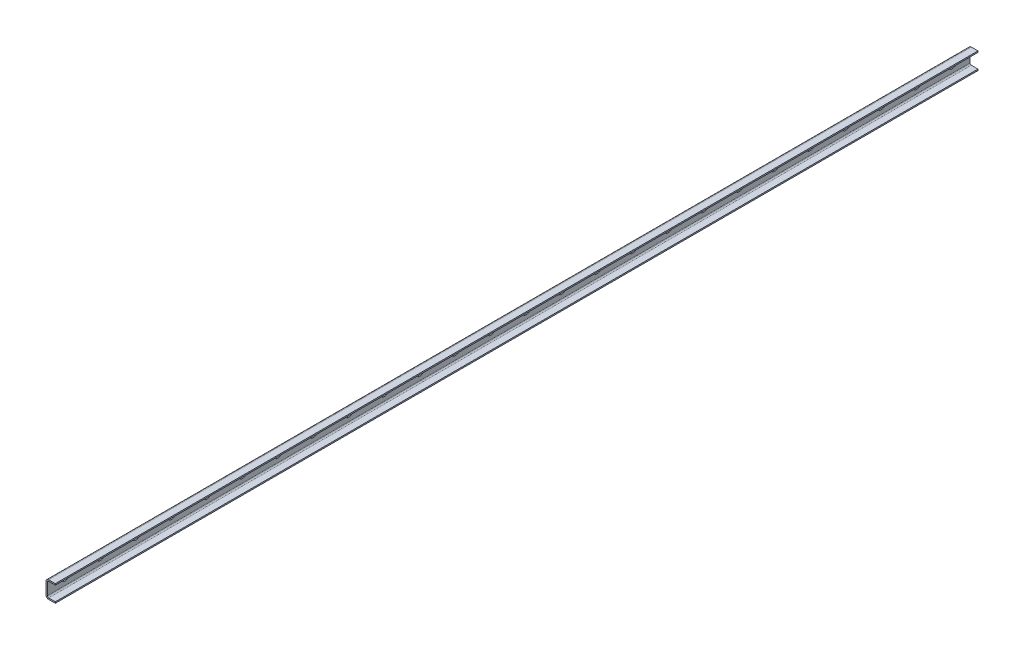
SolidWorks part; units mm, degrees
ref_plane "Front Plane" through (0, 0, 0) normal (0, 0, 1) x (1, 0, 0)
ref_plane "Top Plane" through (0, 0, 0) normal (0, 1, 0) x (1, 0, 0)
ref_plane "Right Plane" through (0, 0, 0) normal (1, 0, 0) x (0, 0, -1)
sketch "Sketch1" plane through (0, 0, 0) normal (0, 0, 1) x (1, 0, 0)
  line L0 (21, 16.25) -> (21, 19.25)
  line L1 (21, 19.25) -> (6, 19.25)
  line L2 (0, 13.25) -> (0, 0)
  line L3 (0, 0) -> (0, -13.25)
  line L4 (6, -19.25) -> (21, -19.25)
  line L5 (21, -19.25) -> (21, -16.25)
  line L6 (21, -16.25) -> (6, -16.25)
  line L7 (3, -13.25) -> (3, 13.25)
  line L8 (6, 16.25) -> (21, 16.25)
  arc A0 (6, 19.25) -> (0, 13.25) centre (6, 13.25) ccw
  arc A1 (0, -13.25) -> (6, -19.25) centre (6, -13.25) ccw
  arc A2 (6, -16.25) -> (3, -13.25) centre (6, -13.25) cw
  arc A3 (3, 13.25) -> (6, 16.25) centre (6, 13.25) cw
  dimension "D1" = 6
  dimension "D2" = 21
  dimension "D3" = 16.25
extrude "Boss-Extrude1" add sketch "Sketch1" against normal blind 2080 contours L7 A3 L8 L0 L1 A0 L2 L3 A1 L4 L5 L6 A2
sketch "Sketch2" plane through (3, 0, 0) normal (1, 0, 0) x (0, 0, -1)
  line L0 (38, 0) -> (42, 0) construction
  line L1 (38, 4.5) -> (42, 4.5)
  line L2 (38, -4.5) -> (42, -4.5)
  arc A0 (38, 4.5) -> (38, -4.5) centre (38, 0) ccw
  arc A1 (42, -4.5) -> (42, 4.5) centre (42, 0) ccw
  point P2 (40, 0)
  point P8 (40, -4.5)
  point P9 (40, 4.5)
  dimension "D1" = 4
  dimension "D2" = 9
  dimension "D3" = 40
extrude "Cut-Extrude1" cut sketch "Sketch2" against normal through all
pattern_linear "LPattern1" count 26 spacing 80 along (0, 0, -1) of "Cut-Extrude1"
